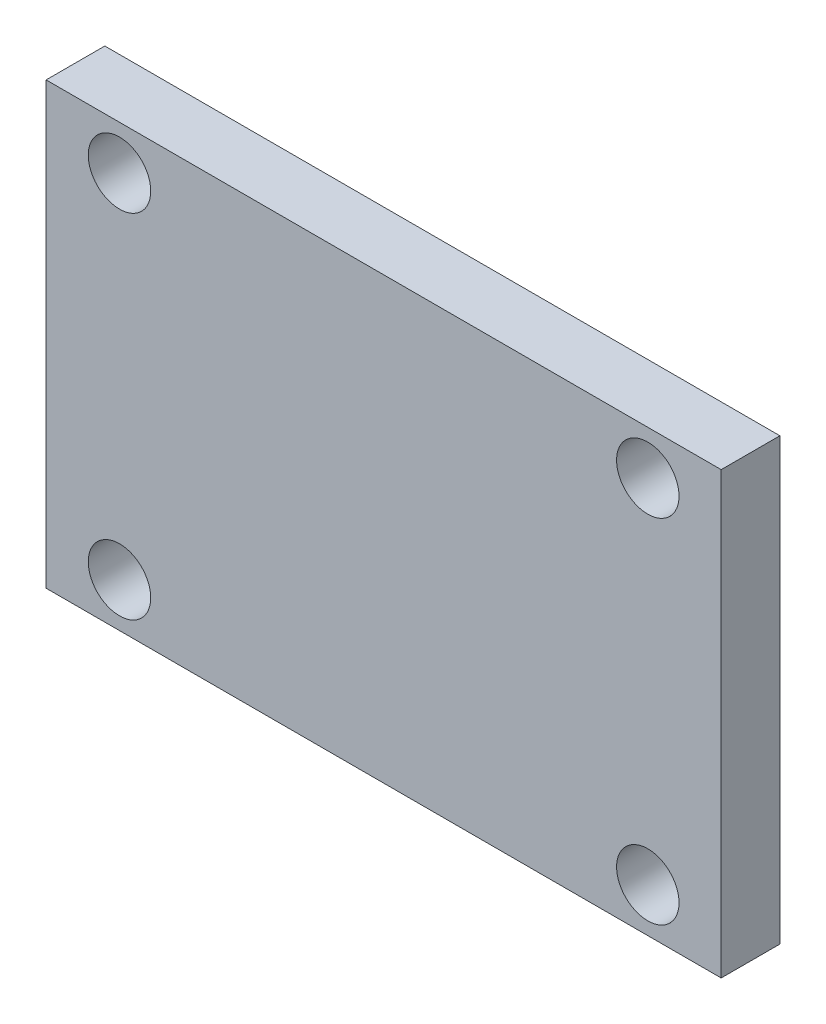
SolidWorks part; units mm, degrees
ref_plane "Front Plane" through (0, 0, 0) normal (0, 0, 1) x (1, 0, 0)
ref_plane "Top Plane" through (0, 0, 0) normal (0, 1, 0) x (1, 0, 0)
ref_plane "Right Plane" through (0, 0, 0) normal (1, 0, 0) x (0, 0, -1)
sketch "Sketch1" plane through (0, 0, 0) normal (0, 0, 1) x (1, 0, 0)
  line L1 (0, 0) -> (73.025, 0)
  line L2 (0, 0) -> (0, 47.625)
  line L3 (0, 47.625) -> (73.025, 47.625)
  line L4 (73.025, 0) -> (73.025, 47.625)
  dimension "D1" = 73.025
  dimension "D2" = 47.625
extrude "Extrude1" add sketch "Sketch1" along normal blind 6.35
hole_wizard "1/4 Clearance Hole1" positions "Sketch3" profile "Sketch2" hole size "1/4" standard "Example Inch"
sketch "Sketch3" plane through (0, 0, 6.35) normal (0, 0, 1) x (1, 0, 0)
  line L0 (0, 23.8125) -> (36.5125, 23.8125) construction
  line L1 (0, 47.625) -> (0, 0) construction
  line L2 (36.5125, 23.8125) -> (36.5125, 0) construction
  line L3 (0, 0) -> (73.025, 0) construction
  point P0 (7.9375, 42.8625)
  point P1 (65.0875, 42.8625)
  point P3 (65.0875, 4.7625)
  point P5 (7.9375, 4.7625)
  dimension "D1" = 57.15
  dimension "D2" = 38.1
sketch "Sketch2" plane through (7.9375, 42.8625, 6.35) normal (1, 0, 0) x (0, -1, 0)
  line L0 (0, 0) -> (0, 6.35)
  line L1 (0, 6.35) -> (3.3782, 6.35)
  line L2 (3.3782, 6.35) -> (3.3782, 0)
  line L5 (3.3782, 0) -> (0, 0)
  line L11 (0, -6.35) -> (0, 107.95) construction
  dimension "Thru Hole Dia." = 6.7564
  dimension "Thru Hole Depth" = 6.35
